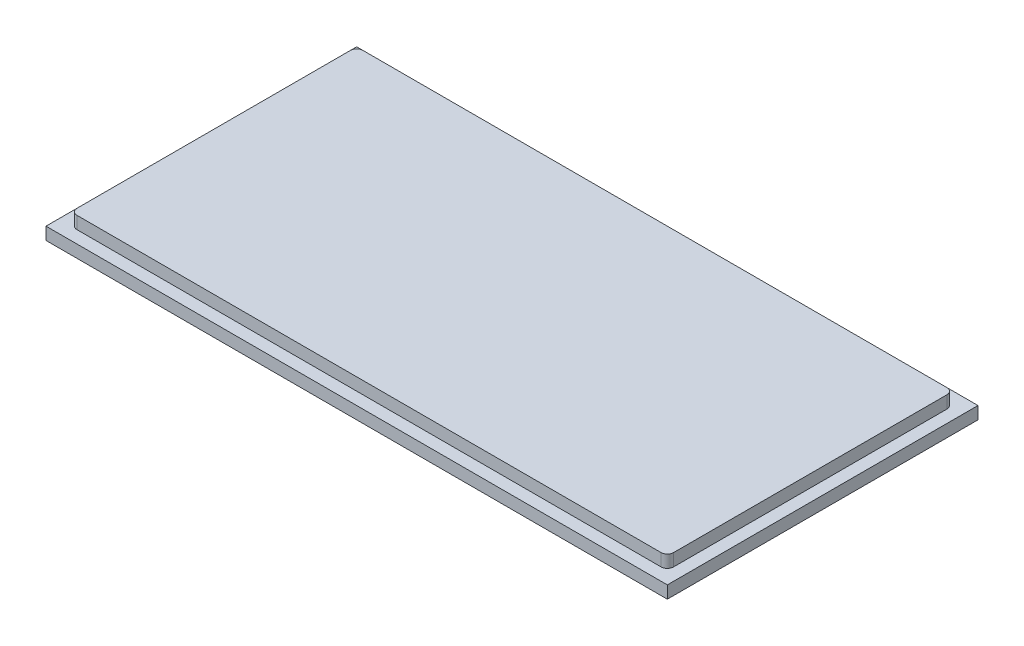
SolidWorks part; units mm, degrees
ref_plane "Front Plane" through (0, 0, 0) normal (0, 0, 1) x (1, 0, 0)
ref_plane "Top Plane" through (0, 0, 0) normal (0, 1, 0) x (1, 0, 0)
ref_plane "Right Plane" through (0, 0, 0) normal (1, 0, 0) x (0, 0, -1)
sketch "Sketch1" plane through (0, 0, 0) normal (0, 1, 0) x (1, 0, 0)
  line L1 (0, 0) -> (127, 0)
  line L2 (0, 0) -> (0, 63.5)
  line L3 (0, 63.5) -> (127, 63.5)
  line L4 (127, 0) -> (127, 63.5)
extrude "Boss-Extrude1" add sketch "Sketch1" along normal blind 2.54
sketch "Sketch2" plane through (0, 2.54, 0) normal (0, 1, 0) x (1, 0, 0)
  line L0 (0, 0) -> (2.54, 0)
  line L1 (0, 0) -> (127, 0) construction
  line L2 (2.54, 0) -> (2.54, 2.54)
  line L3 (127, 63.5) -> (124.46, 63.5)
  line L4 (127, 63.5) -> (0, 63.5) construction
  line L5 (124.46, 63.5) -> (124.46, 60.96)
  line L7 (3.81, 2.54) -> (123.19, 2.54)
  line L8 (2.54, 3.81) -> (2.54, 59.69)
  line L9 (3.81, 60.96) -> (123.19, 60.96)
  line L10 (124.46, 3.81) -> (124.46, 59.69)
  arc A0 (124.46, 3.81) -> (123.19, 2.54) centre (123.19, 3.81) cw
  arc A1 (3.81, 2.54) -> (2.54, 3.81) centre (3.81, 3.81) cw
  arc A2 (2.54, 59.69) -> (3.81, 60.96) centre (3.81, 59.69) cw
  arc A3 (124.46, 59.69) -> (123.19, 60.96) centre (123.19, 59.69) ccw
  point P12 (0, 0)
  dimension "D1" = 1.27
extrude "Boss-Extrude2" add sketch "Sketch2" along normal blind 2.54 contours L10 A3 L9 A2 L8 A1 L7 A0
